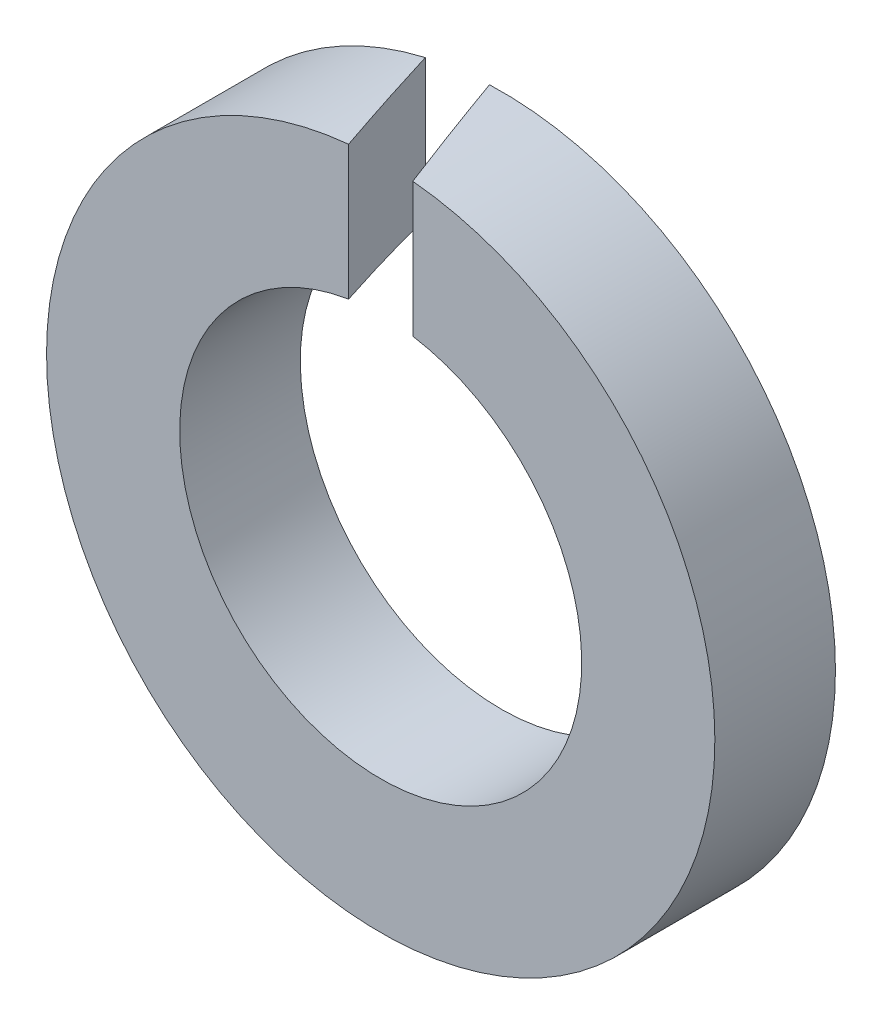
SolidWorks part; units mm, degrees
ref_plane "Front" through (0, 0, 0) normal (0, 0, 1) x (1, 0, 0)
ref_plane "Top" through (0, 0, 0) normal (0, 1, 0) x (1, 0, 0)
ref_plane "Right" through (0, 0, 0) normal (1, 0, 0) x (0, 0, -1)
other "Configuration Table"
sketch "Sketch1" plane through (0, 0, 0) normal (0, 0, 1) x (1, 0, 0)
  circle A0 centre (0, 0) radius 13.3
  circle A1 centre (0, 0) radius 8
  dimension "d" = 16
  dimension "b" = 5.3
extrude "Base-Extrude" add sketch "Sketch1" against normal blind 4.8
sketch "Sketch2" plane through (-3.0216, 0, -2.3453) normal (0, 1, 0) x (0, 0, -1)
  line L0 (0.7451, -1.8968) -> (-7.0218, -4.7237) construction
  line L1 (-2.3453, -1.7446) -> (2.4547, 0.0024)
  line L2 (2.4547, -16.3216) -> (2.4547, 10.2784) construction
  line L5 (-2.3453, -4.2986) -> (2.4547, -2.5516)
  line L6 (-2.3453, -1.7446) -> (-2.3453, -4.2986)
  line L7 (2.4547, 0.0024) -> (2.4547, -2.5516)
  line L8 (-2.3453, 4.9784) -> (-2.3453, -11.0216) construction
  line L10 (-2.3453, 10.2784) -> (-2.3453, -16.3216) construction
  dimension "D1" = 70
  dimension "m" = 2.4
  dimension "D3" = 2.4
extrude "Cut-Extrude1" cut sketch "Sketch2" along normal through all
